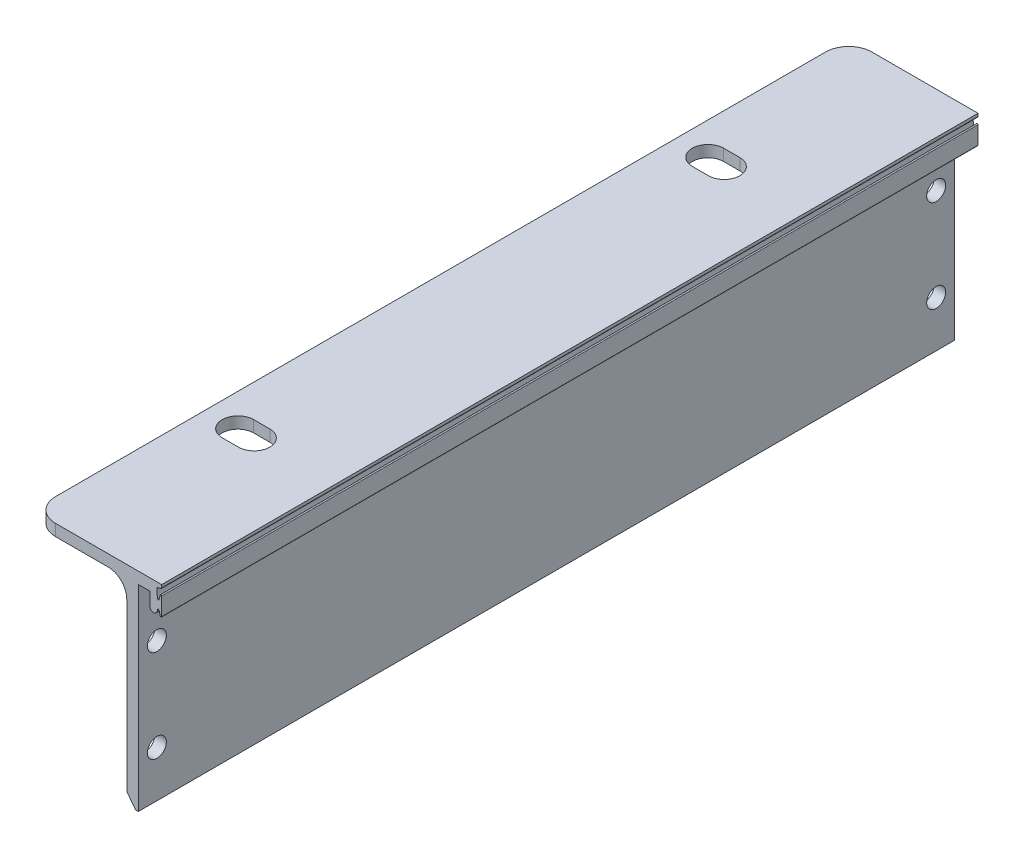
SolidWorks part; units mm, degrees
ref_plane "前视基准面" through (0, 0, 0) normal (0, 0, 1) x (1, 0, 0)
ref_plane "上视基准面" through (0, 0, 0) normal (0, 1, 0) x (1, 0, 0)
ref_plane "右视基准面" through (0, 0, 0) normal (1, 0, 0) x (0, 0, -1)
sketch "草图1" plane through (0, 0, 0) normal (0, 0, 1) x (1, 0, 0)
  line L1 (2137.4351, -3066.2715) -> (2137.4351, -3069.1377)
  line L2 (2139.9751, -3063.7715) -> (2139.9751, -3064.3461)
  line L886 (2138.9752, -3069.3427) -> (2139.1203, -3068.8072)
  line L887 (2137.4351, -3066.2715) -> (2137.4351, -3069.1377)
  line L888 (2134.9351, -3066.2715) -> (2137.4351, -3066.2715)
  line L889 (2139.4107, -3068.8105) -> (2139.6548, -3069.798)
  line L890 (2134.9351, -3066.2715) -> (2134.9351, -3108.7715)
  line L891 (2134.9351, -3108.7715) -> (2134.3351, -3108.7715)
  line L892 (2139.9751, -3065.934) -> (2139.9751, -3069.759)
  line L893 (2132.4351, -3106.2715) -> (2134.3351, -3108.7715)
  line L894 (2132.4351, -3070.2715) -> (2132.4351, -3106.2715)
  line L895 (2139.4107, -3066.8825) -> (2139.6548, -3065.895)
  line L896 (2112.0351, -3066.2715) -> (2128.4351, -3066.2715)
  line L897 (2112.0351, -3063.7715) -> (2112.0351, -3066.2715)
  line L898 (2112.0351, -3063.7715) -> (2139.9751, -3063.7715)
  line L899 (2139.9751, -3063.7715) -> (2139.9751, -3064.3461)
  line L900 (2139.174, -3064.7312) -> (2139.723, -3064.6423)
  arc A123 (2137.4351, -3069.1377) -> (2138.9752, -3069.3427) centre (2138.2188, -3069.1377) ccw
  arc A124 (2139.4107, -3068.8105) -> (2139.1203, -3068.8072) centre (2139.2651, -3068.8465) ccw
  arc A125 (2139.6548, -3069.798) -> (2139.9751, -3069.759) centre (2139.8126, -3069.759) ccw
  arc A126 (2139.9751, -3065.934) -> (2139.6548, -3065.895) centre (2139.8126, -3065.934) ccw
  arc A127 (2139.1161, -3066.864) -> (2139.4107, -3066.8825) centre (2139.2651, -3066.8465) ccw
  arc A128 (2138.9221, -3065.0153) -> (2139.1161, -3066.864) centre (2145.3632, -3065.274) ccw
  arc A129 (2139.174, -3064.7312) -> (2138.9221, -3065.0153) centre (2139.2219, -3065.0273) ccw
  arc A130 (2139.723, -3064.6423) -> (2139.9751, -3064.3461) centre (2139.6751, -3064.3461) ccw
  arc A131 (2132.4351, -3070.2715) -> (2128.4351, -3066.2715) centre (2128.4351, -3070.2715) ccw
extrude "凸台-拉伸1" add sketch "草图1" along normal mid plane 176.45 contours A131 L894 L893 L891 L890 L888 L1 A123 L886 A124 L889 A125 L892 A126 L895 A127 A128 A129 L900 A130 L2 L898 L897 L896
sketch "草图8" plane through (2132.4351, 0, 0) normal (-1, 0, 0) x (0, 0, 1)
  line L0 (-88.225, -3070.2715) -> (-88.225, -3106.2715) construction
  line L1 (88.225, -3063.7715) -> (-88.225, -3063.7715) construction
  line L2 (0, -3106.2715) -> (0, -3066.2715) construction
  line L3 (88.225, -3106.2715) -> (-88.225, -3106.2715) construction
  line L4 (88.225, -3066.2715) -> (-88.225, -3066.2715) construction
  circle A0 centre (-84.225, -3078.7715) radius 2.05
  circle A1 centre (-84.225, -3098.7715) radius 2.05
  circle A2 centre (84.225, -3098.7715) radius 2.05
  circle A3 centre (84.225, -3078.7715) radius 2.05
  dimension "D1" = 4.1
  dimension "D2" = 4.1
  dimension "D3" = 4
  dimension "D4" = 20
  dimension "D5" = 4
  dimension "D6" = 15
extrude "切除-拉伸7" cut sketch "草图8" against normal blind 132
sketch "草图4" plane through (0, -3063.7715, 0) normal (0, 1, 0) x (1, 0, 0)
  line L0 (2119.0351, 50.8) -> (2122.5351, 50.8) construction
  line L2 (2119.0351, 54.2) -> (2122.5351, 54.2)
  line L3 (2119.0351, 47.4) -> (2122.5351, 47.4)
  line L4 (2112.0351, -88.225) -> (2112.0351, 88.225) construction
  line L5 (2139.9751, 0) -> (2112.0351, 0) construction
  line L6 (2139.9751, -88.225) -> (2139.9751, 88.225) construction
  line L7 (2119.0351, -50.8) -> (2122.5351, -50.8) construction
  line L8 (2119.0351, -54.2) -> (2122.5351, -54.2)
  line L9 (2119.0351, -47.4) -> (2122.5351, -47.4)
  arc A0 (2119.0351, 54.2) -> (2119.0351, 47.4) centre (2119.0351, 50.8) ccw
  arc A1 (2122.5351, 47.4) -> (2122.5351, 54.2) centre (2122.5351, 50.8) ccw
  arc A2 (2119.0351, -54.2) -> (2119.0351, -47.4) centre (2119.0351, -50.8) cw
  arc A3 (2122.5351, -47.4) -> (2122.5351, -54.2) centre (2122.5351, -50.8) cw
  point P4 (2120.7851, 50.8)
  point P17 (2120.7851, -50.8)
  dimension "D1" = 3.4
  dimension "D3" = 101.6
  dimension "D2" = 3.5
  dimension "D4" = 8.75
extrude "切除-拉伸2" cut sketch "草图4" against normal blind 132
fillet "圆角1" radius 5 2 edges at (2112.0351, -3065.0215, -88.225) (2112.0351, -3065.0215, 88.225)
